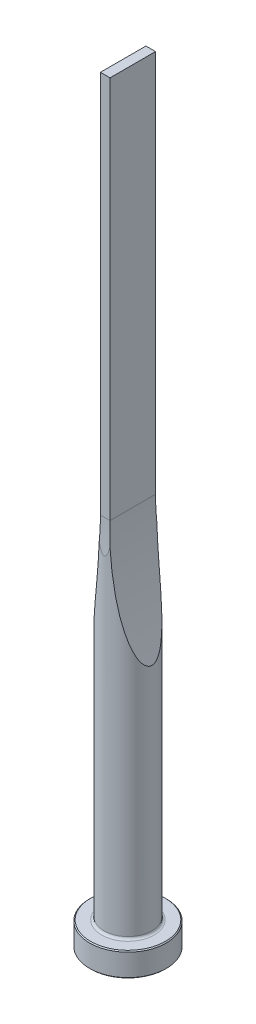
SolidWorks part; units mm, degrees
ref_plane "Front Plane" through (0, 0, 0) normal (0, 0, 1) x (1, 0, 0)
ref_plane "Top Plane" through (0, 0, 0) normal (0, 1, 0) x (1, 0, 0)
ref_plane "Right Plane" through (0, 0, 0) normal (1, 0, 0) x (0, 0, -1)
sketch "Sketch1" plane through (0, 0, 0) normal (0, 0, 1) x (1, 0, 0)
  line L0 (0, 0) -> (7.8, 0)
  line L1 (55, 0) -> (-55, 0) construction
  line L2 (8, 0.2) -> (8, 4.8)
  line L3 (7.8, 5) -> (5.5, 5)
  line L4 (5, 5.5) -> (5, 160)
  line L5 (0, 160) -> (5, 160)
  line L6 (8, 4.8) -> (7.8, 5)
  line L7 (7.8, 0) -> (8, 0.2)
  line L8 (0, 160) -> (0, 0)
  arc A0 (5, 5.5) -> (5.5, 5) centre (5.5, 5.5) ccw
  point P1 (8, 0)
  point P6 (8, 5)
  dimension "D4" = 0.5
  dimension "D1" = 5
  dimension "D2" = 8
  dimension "D3" = 5
  dimension "D5" = 160
revolve "Revolve1" add sketch "Sketch1" angle 360 about L8
sketch "Sketch2" plane through (0, 0, 0) normal (0, 0, 1) x (1, 0, 0)
  line L0 (1, 160) -> (1, 80)
  line L1 (5, 160) -> (-5, 160) construction
  line L2 (-1, 160) -> (-1, 80)
  line L3 (5, 160) -> (5, 53.467)
  line L4 (-5, 160) -> (-5, 53.467)
  line L5 (0, -8.8) -> (0, 8.8) construction
  line L6 (5, 160) -> (1, 160)
  line L8 (-1, 160) -> (-5, 160)
  arc A0 (1, 80) -> (5, 53.467) centre (91, 80) ccw
  arc A1 (-1, 80) -> (-5, 53.467) centre (-91, 80) cw
  dimension "D4" = 90
  dimension "D1" = 80
  dimension "D2" = 2
  dimension "D3" = 1
extrude "Cut-Extrude1" cut sketch "Sketch2" against normal mid plane 10
sketch "Sketch3" plane through (0, 0, 0) normal (1, 0, 0) x (0, 0, -1)
  line L0 (4.75, 160) -> (4.75, 80)
  line L1 (-4.899, 160) -> (4.899, 160) construction
  line L2 (-4.75, 160) -> (-4.75, 80)
  line L3 (5, 160) -> (5, 73.2965)
  line L4 (4.75, 160) -> (5, 160)
  line L5 (0, 8.8) -> (0, -8.8) construction
  line L6 (-5, 160) -> (-5, 73.2965)
  line L8 (-4.75, 160) -> (-5, 160)
  arc A0 (4.75, 80) -> (5, 73.2965) centre (94.75, 80) ccw
  arc A1 (-4.75, 80) -> (-5, 73.2965) centre (-94.75, 80) cw
  dimension "D2" = 90
  dimension "D1" = 80
  dimension "D3" = 9.5
  dimension "D4" = 4.75
extrude "Cut-Extrude2" cut sketch "Sketch3" against normal mid plane 10
